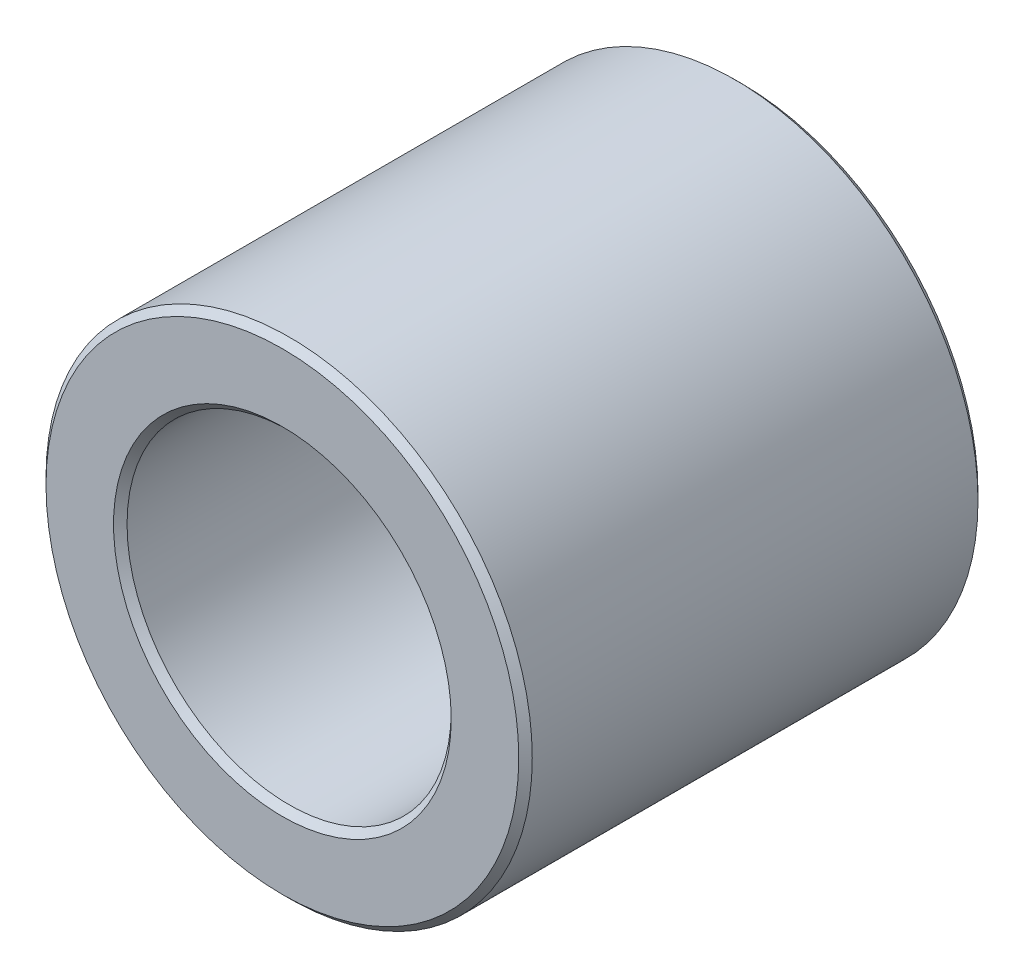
SolidWorks part; units mm, degrees
ref_plane "Face" through (0, 0, 0) normal (0, 0, 1) x (1, 0, 0)
ref_plane "Dessus" through (0, 0, 0) normal (0, 1, 0) x (1, 0, 0)
ref_plane "Droite" through (0, 0, 0) normal (1, 0, 0) x (0, 0, -1)
sketch "Esquisse1" plane through (0, 0, 0) normal (0, 0, 1) x (1, 0, 0)
  circle A1 centre (0, 0) radius 9
  circle A3 centre (0, 0) radius 6
  dimension "D1" = 12
  dimension "D2" = 18
extrude "Extrusion1" add sketch "Esquisse1" against normal blind 17
chamfer "Chanfrein1" distance 0.25 angle 45 4 edges at (9, 0, -17) (6, 0, -17) (9, 0, 0) (6, 0, 0)
